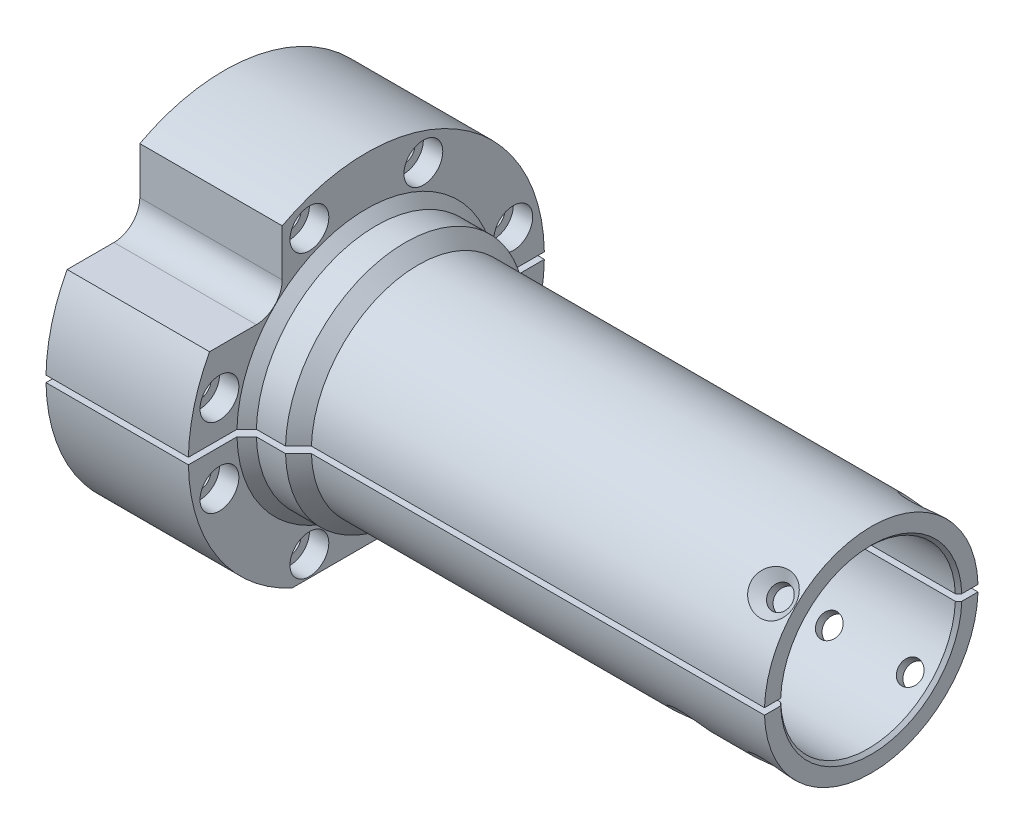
SolidWorks part; units mm, degrees
ref_plane "Vorne" through (0, 0, 0) normal (0, 0, 1) x (1, 0, 0)
ref_plane "Oben" through (0, 0, 0) normal (0, 1, 0) x (1, 0, 0)
ref_plane "Rechts" through (0, 0, 0) normal (1, 0, 0) x (0, 0, -1)
sketch "Skizze1" plane through (0, 0, 0) normal (0, 0, 1) x (1, 0, 0)
  line L0 (39.7, 27.5) -> (61.7, 27.5) construction
  line L1 (39.7, 27.5) -> (39.7, 0) construction
  line L2 (39.7, 16.5) -> (57.7, 16.5) construction
  line L3 (61.7, 27.5) -> (61.7, 18.5) construction
  line L5 (61.7, 18.5) -> (69.7, 18.5) construction
  line L6 (57.7, 14.5) -> (81.7, 14.5) construction
  line L7 (69.7, 18.5) -> (69.7, 16.5) construction
  line L8 (69.7, 16.5) -> (139.7, 16.5) construction
  line L9 (81.7, 14.5) -> (81.7, 13.5) construction
  line L10 (81.7, 13.5) -> (139.7, 13.5) construction
  line L11 (139.7, 16.5) -> (139.7, 13.5) construction
  line L12 (39.7, 27.5) -> (61.7, 27.5)
  line L13 (39.7, 27.5) -> (39.7, 16.5)
  line L14 (39.7, 16.5) -> (57.7, 16.5)
  line L15 (61.7, 27.5) -> (61.7, 18.5)
  line L17 (61.7, 18.5) -> (69.7, 18.5)
  line L18 (57.7, 14.5) -> (81.7, 14.5)
  line L19 (69.7, 18.5) -> (69.7, 16.5)
  line L20 (69.7, 16.5) -> (139.7, 16.5)
  line L21 (81.7, 14.5) -> (81.7, 13.5)
  line L22 (81.7, 13.5) -> (139.7, 13.5)
  line L23 (139.7, 16.5) -> (139.7, 13.5)
  line L24 (-200068.1765, 0) -> (200114.16, 0) construction
  line L25 (-200068.1765, 0) -> (200114.16, 0)
  line L27 (57.7, 14.5) -> (57.7, 16.5) construction
  line L28 (57.7, 14.5) -> (57.7, 16.5)
revolve "Rotation1" add sketch "Skizze1" angle 360 about L25
sketch "Skizze2" plane through (61.7, 0, 0) normal (1, 0, 0) x (0, 0, -1)
  line L0 (-13, 24.2332) -> (-13, 17)
  line L1 (-17, 13) -> (-24.2332, 13)
  line L2 (-14.1716, 14.1716) -> (-17, 17) construction
  line L3 (0, 0) -> (0, 21.8667) construction
  line L4 (0, 0) -> (-6.0001, 6.0001) construction
  circle A0 centre (0, 0) radius 27.5 construction
  arc A1 (-13, 24.2332) -> (-24.2332, 13) centre (0, 0) ccw
  arc A2 (-13, 17) -> (-17, 13) centre (-17, 17) cw
  circle A3 centre (0, 0) radius 24 construction
  circle A4 centre (-17, 17) radius 3.5 construction
  dimension "D1" = 45
  dimension "D2" = 48
  dimension "D4" = 13
  dimension "D3" = 4
extrude "Schnitt-Linear austragen1" cut sketch "Skizze2" against normal through all
pattern_circular "Kreismuster1" count 2 over 360 about axis through (0, 0, 0) along (1, 0, 0) of "Schnitt-Linear austragen1"
sketch "Skizze3" plane through (39.7, 0, 0) normal (-1, 0, 0) x (0, 0, 1)
  line L3 (0, 0) -> (-10, -10) construction
  line L6 (0, 0) -> (0, 8.7203) construction
  line L7 (10, 10) -> (0, 0) construction
  line L10 (-8.9406, 8.9406) -> (10.1731, -10.1731) construction
  line L11 (7, 18) -> (-10, 18)
  line L12 (-18, 10) -> (-18, -7)
  line L13 (10, -18) -> (-7, -18)
  line L14 (18, 7) -> (18, -10)
  arc A7 (9.5061, 16.649) -> (16.649, 9.5061) centre (30.3907, 30.3907) ccw
  arc A8 (-16.649, -9.5061) -> (-9.5061, -16.649) centre (-30.3907, -30.3907) cw
  arc A9 (9.5061, 16.649) -> (7, 18) centre (7, 15) ccw
  arc A10 (-10, 18) -> (-18, 10) centre (-10, 10) ccw
  arc A12 (-18, -7) -> (-16.649, -9.5061) centre (-15, -7) ccw
  arc A13 (16.649, 9.5061) -> (18, 7) centre (15, 7) cw
  arc A14 (-7, -18) -> (-9.5061, -16.649) centre (-7, -15) cw
  arc A15 (18, -10) -> (10, -18) centre (10, -10) cw
  dimension "D1" = 3
  dimension "D5" = 18
  dimension "D7" = 45
  dimension "D2" = 25
  dimension "D8" = 7
  dimension "D4" = 18
  dimension "D3" = 8
  dimension "D6" = 45
  dimension "D9" = 7
extrude "Schnitt-Linear austragen2" cut sketch "Skizze3" against normal blind 18
hole_wizard "Stirnsenkung für M3 Zylinderschraube mit Innensechskant1" positions "Skizze5" profile "Skizze4" counterbore size "M3" standard "ISO"
sketch "Skizze5" plane through (61.7, 0, 0) normal (1, 0, 0) x (0, 0, -1)
  line L0 (-23.8505, 0) -> (34.2176, 0) construction
  line L2 (22.6993, -6.0822) -> (0, 0) construction
  line L3 (0, 0) -> (8.8033, 21.7888) construction
  line L5 (-22.6993, 6.0822) -> (0, 0) construction
  line L6 (0, 0) -> (-8.8033, -21.7888) construction
  circle A0 centre (0, 0) radius 23.5 construction
  point P0 (8.8033, 21.7888)
  point P1 (-22.6993, 6.0822)
  point P3 (-8.8033, -21.7888)
  point P5 (22.6993, -6.0822)
  dimension "D3" = 47
  dimension "D1" = 112
  dimension "D2" = 15
sketch "Skizze4" plane through (61.7, 21.7888, -8.8033) normal (0, 1, 0) x (0, 0, -1)
  line L0 (0, 0) -> (0, 22)
  line L1 (0, 22) -> (1.7, 22)
  line L3 (1.7, 22) -> (1.7, 3)
  line L4 (1.7, 3) -> (3, 3)
  line L5 (3, 3) -> (3, 0)
  line L7 (3, 0) -> (0, 0)
  line L11 (0, -6.35) -> (0, 107.95) construction
  dimension "Bohrerdurchmesser" = 3.4
  dimension "Bohrungstiefe" = 22
  dimension "Senkdurchmesser2" = 6
  dimension "Senktiefe2" = 3
hole_wizard "Stirnsenkung für M3 Zylinderschraube mit Innensechskant2" positions "Skizze10" profile "Skizze9" counterbore size "M3" standard "ISO"
sketch "Skizze10" plane through (61.7, 0, 0) normal (1, 0, 0) x (0, 0, -1)
  line L0 (0, 7.1458) -> (0, 0) construction
  line L1 (0, 0) -> (-8.8033, 21.7888) construction
  line L6 (-22.6993, -6.0822) -> (22.6993, 6.0822) construction
  line L8 (-13.5, 0) -> (13.053, 0) construction
  line L10 (8.8033, -21.7888) -> (0, 0) construction
  circle A0 centre (0, 0) radius 23.5 construction
  circle A1 centre (0, 0) radius 13.5 construction
  point P0 (22.6993, 6.0822)
  point P1 (-8.8033, 21.7888)
  point P3 (-22.6993, -6.0822)
  point P5 (8.8033, -21.7888)
  dimension "D1" = 68
  dimension "D2" = 15
sketch "Skizze9" plane through (61.7, 6.0822, -22.6993) normal (0, 1, 0) x (0, 0, -1)
  line L0 (0, 0) -> (0, 22)
  line L1 (0, 22) -> (1.7, 22)
  line L3 (1.7, 22) -> (1.7, 3)
  line L4 (1.7, 3) -> (3, 3)
  line L5 (3, 3) -> (3, 0)
  line L7 (3, 0) -> (0, 0)
  line L11 (0, -6.35) -> (0, 107.95) construction
  dimension "Bohrerdurchmesser" = 3.4
  dimension "Bohrungstiefe" = 22
  dimension "Senkdurchmesser2" = 6
  dimension "Senktiefe2" = 3
chamfer "Fase1" distance 2 angle 45 1 edges at (69.7, 0, 18.5)
ref_plane "Ebene2" through (0, 0, 0) normal (0, 0.7071, 0.7071) x (1, 0, 0)
ref_plane "Ebene4" through (0, -11.6673, -11.6673) normal (0, -0.7071, -0.7071) x (-1, 0, 0)
hole_wizard "Formsenkung für M3 Senkschraube mit Innensechskant1" positions "Skizze8" profile "Skizze7" countersink size "M3" standard "ISO"
sketch "Skizze8" plane through (-145.95, -11.6673, -11.6673) normal (0, 0.7071, 0.7071) x (-1, 0, 0)
  line L0 (-285.65, 0) -> (-215.65, 0) construction
  line L1 (-285.65, 16.5) -> (-285.65, -16.5) construction
  point P0 (-282.15, 0)
  dimension "D1" = 3.5
sketch "Skizze7" plane through (136.2, -11.6673, -11.6673) normal (1, 0, 0) x (0, 0.7071, -0.7071)
  line L0 (0, 0) -> (0, 17.5505)
  line L1 (0, 17.5505) -> (1.75, 16.499)
  line L2 (1.75, 16.499) -> (1.75, 1.6)
  line L3 (1.75, 1.6) -> (3.35, 0)
  line L5 (3.35, 0) -> (0, 0)
  line L6 (-1.75, 1.6) -> (-3.35, 0) construction
  line L10 (0, 17.5505) -> (-1.75, 16.499) construction
  line L11 (0, -6.35) -> (0, 107.95) construction
  dimension "Bohrerdurchmesser" = 3.5
  dimension "Bohrungstiefe" = 16.499
  dimension "Senkdurchmesser (Oben)" = 6.7
  dimension "Senkwinkel (Oben)" = 90
  dimension "Spitzenwinkel" = 118
pattern_circular "Kreismuster2" count 4 over 360 about axis through (-200068.1765, 0, 0) along (-1, 0, 0) of "Formsenkung für M3 Senkschraube mit Innensechskant1"
pattern_linear "Lineares Muster1" count 2 spacing 12.5 along (-1, 0, 0) of "Formsenkung für M3 Senkschraube mit Innensechskant1"
pattern_circular "Kreismuster3" count 2 over 90 about axis through (-200068.1765, 0, 0) along (-1, 0, 0) of "Lineares Muster1"
chamfer "Fase2" distance 1.5 angle 45 1 edges at (61.7, 0, 18.5)
chamfer "Fase3" distance 0.5 angle 45 1 edges at (139.7, 0, 13.5)
sketch "Skizze6" plane through (0, 0, 0) normal (0, 0, -1) x (-1, 0, 0)
  line L0 (-39.7, -27.5) -> (-39.7, 13) construction
  line L1 (-39.7, 0.5) -> (-139.7, 0.5)
  line L2 (-39.7, 0.5) -> (-39.7, -0.5)
  line L3 (-39.7, -0.5) -> (-139.7, -0.5)
  line L4 (-139.7, 0.5) -> (-139.7, -0.5)
  line L6 (-139.7, 16.5) -> (-139.7, -16.5) construction
  line L7 (-39.7, 0) -> (0, 0) construction
  dimension "D1" = 1
extrude "Schnitt-Linear austragen4" cut sketch "Skizze6" against normal mid plane 200
sketch "Skizze11" plane through (39.7, 0, 0) normal (-1, 0, 0) x (0, 0, 1)
  line L0 (-11.4564, -25) -> (11.4564, -25)
  arc A0 (-13, -24.2332) -> (27.4955, -0.5) centre (0, 0) ccw construction
  arc A1 (-11.4564, -25) -> (11.4564, -25) centre (0, 0) ccw
  dimension "D1" = 25
extrude "Schnitt-Linear austragen5" cut sketch "Skizze11" against normal through all
chamfer "Fase4" distance 2.5 angle 45 1 edges at (57.7, 14.5, 0)
chamfer "Fase5" distance 2.5 angle 45 1 edges at (57.7, -14.5, 0)
